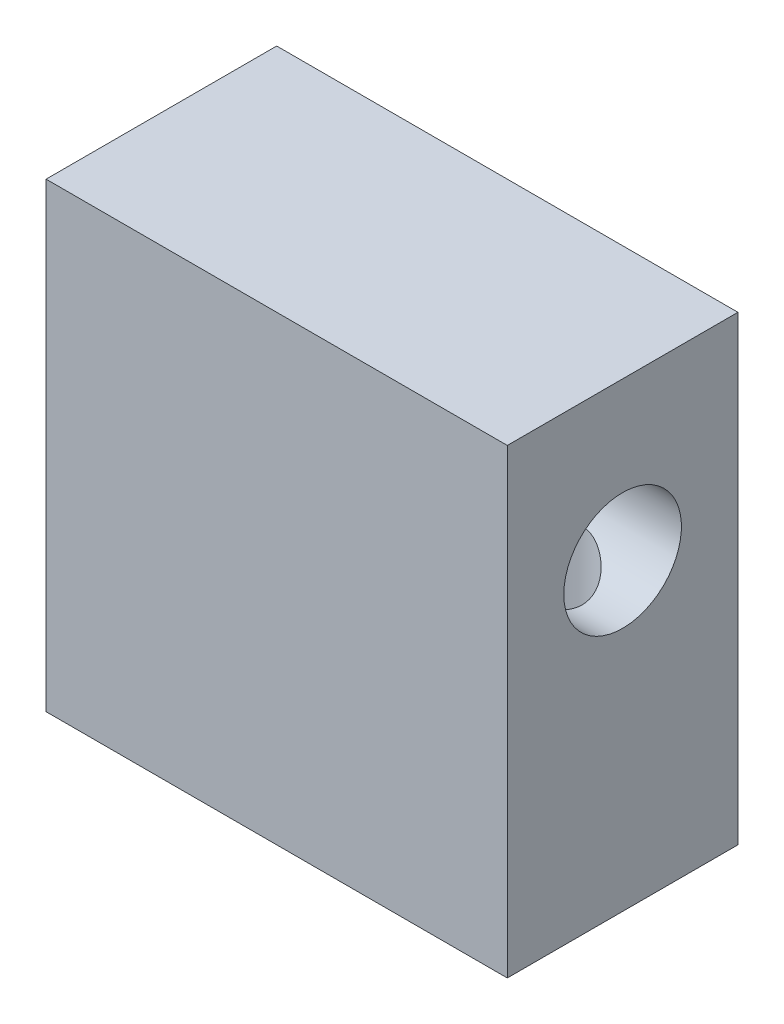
SolidWorks part; units mm, degrees
ref_plane "Plane1" through (0, 0, 0) normal (0, 0, 1) x (1, 0, 0)
ref_plane "Plane2" through (0, 0, 0) normal (0, 1, 0) x (1, 0, 0)
ref_plane "Plane3" through (0, 0, 0) normal (1, 0, 0) x (0, 0, -1)
sketch "Sketch1" plane through (0, 0, 0) normal (0, 0, 1) x (1, 0, 0)
  line L0 (0, 0) -> (25.4, 0)
  line L1 (0, 0) -> (0, 25.4)
  line L2 (25.4, 25.4) -> (0, 25.4)
  line L3 (25.4, 25.4) -> (25.4, 0)
  dimension "D1" = 25.4
  dimension "D2" = 25.4
extrude "Base-Extrude" add sketch "Sketch1" along normal blind 12.7
sketch "Sketch4" plane through (0, 0, 0) normal (-1, 0, 0) x (0, 0, 1)
  line L0 (12.7, 0) -> (0, 0) construction
  circle A0 centre (6.35, 16.7386) radius 3.2385
  dimension "D1" = 6.477
  dimension "D2" = 16.7386
  dimension "D3" = 6.35
extrude "Cut-Extrude1" cut sketch "Sketch4" against normal through all
sketch "Sketch5" plane through (0, 0, 0) normal (0, -1, 0) x (1, 0, 0)
  line L0 (0, 12.7) -> (0, 0) construction
  line L1 (0, 0) -> (25.4, 0) construction
  circle A0 centre (4.7498, 6.35) radius 2.54
  circle A1 centre (20.6248, 6.35) radius 2.54
  dimension "D1" = 5.08
  dimension "D2" = 5.08
  dimension "D3" = 4.7498
  dimension "D4" = 15.875
  dimension "D5" = 6.35
  dimension "D6" = 6.35
extrude "Cut-Extrude2" cut sketch "Sketch5" against normal blind 19.05
